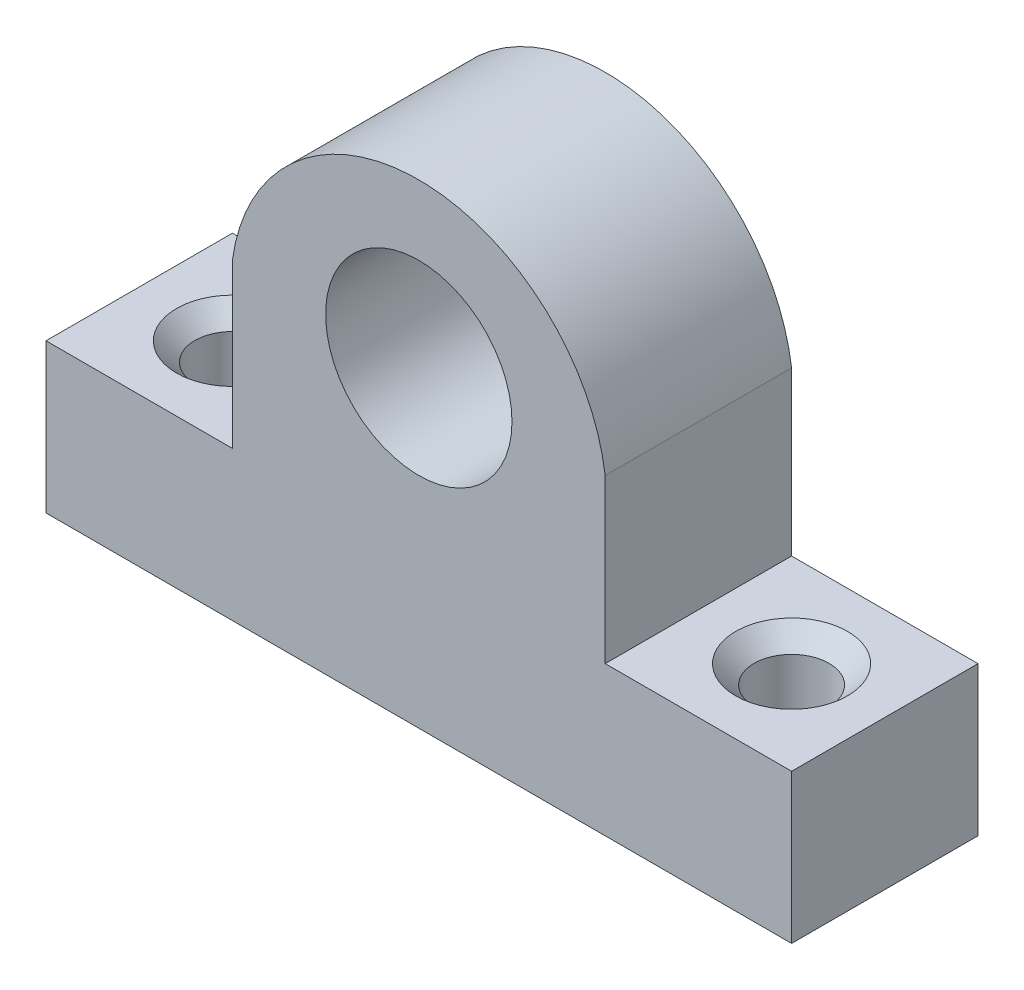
SolidWorks part; units mm, degrees
ref_plane "Front Plane" through (0, 0, 0) normal (0, 0, 1) x (1, 0, 0)
ref_plane "Top Plane" through (0, 0, 0) normal (0, 1, 0) x (1, 0, 0)
ref_plane "Right Plane" through (0, 0, 0) normal (1, 0, 0) x (0, 0, -1)
sketch "Sketch2" plane through (0, 0, 0) normal (0, 0, 1) x (1, 0, 0)
  line L4 (0, 0) -> (50.8, 0)
  line L7 (0, 0) -> (0, 10.16)
  line L8 (0, 10.16) -> (50.8, 10.16)
  line L9 (50.8, 0) -> (50.8, 10.16)
  line L10 (25.4, 10.16) -> (0, 10.16)
  line L11 (12.7, 10.16) -> (12.7, 29.21)
  line L12 (25.4, 10.16) -> (50.8, 10.16)
  line L14 (50.8, 10.16) -> (25.4, 10.16)
  line L16 (38.1, 10.16) -> (38.1, 29.21)
  line L25 (12.7, 10.16) -> (38.1, 10.16)
  line L26 (12.7, 10.16) -> (12.7, 32.3596)
  line L27 (12.7, 32.3596) -> (38.1, 32.3596)
  line L28 (38.1, 10.16) -> (38.1, 32.3596)
  dimension "D1" = 50.8
  dimension "D2" = 10.16
  dimension "D3" = 19.05
extrude "Boss-Extrude1" add sketch "Sketch2" along normal blind 12.7 contours L7 L4 L9 L8 | L26 L25 L28 L27
sketch "Sketch8" plane through (0, 0, 12.7) normal (0, 0, 1) x (1, 0, 0)
  line L0 (12.7, 10.16) -> (12.7, 32.3596) construction
  line L1 (38.1, 10.16) -> (38.1, 32.3596) construction
  line L2 (12.7, 21.2598) -> (12.7, 33.6209)
  line L3 (12.7, 33.6209) -> (38.1, 33.6209)
  line L4 (38.1, 33.6209) -> (38.1, 21.2598)
  arc A0 (12.7, 21.2598) -> (38.1, 21.2598) centre (25.4, 19.5443) cw
extrude "Cut-Extrude3" cut sketch "Sketch8" against normal through all both and the other way through all
sketch "Sketch9" plane through (0, 0, 12.7) normal (0, 0, 1) x (1, 0, 0)
  line L0 (12.7, 21.2598) -> (38.1, 21.2598)
  circle A0 centre (25.4, 21.2598) radius 6.35
  dimension "D1" = 12.7
extrude "Cut-Extrude4" cut sketch "Sketch9" against normal through all both and the other way through all contours A0
sketch "Sketch10" plane through (0, 10.16, 0) normal (0, 1, 0) x (1, 0, 0)
  line L0 (50.8, 0) -> (38.1, 0)
  line L1 (38.1, 0) -> (44.45, 0)
  line L2 (0, 0) -> (6.35, -6.35)
  line L3 (38.1, -12.7) -> (50.8, -12.7) construction
  line L4 (44.45, -12.7) -> (44.45, -6.35)
  line L7 (6.35, -6.35) -> (44.45, -6.35)
  point P9 (44.45, -6.35)
  point P10 (6.35, -6.35)
hole_wizard "1/4-20 Tapped Hole2" positions "Sketch10" profile "Sketch11" tap size "1/4-20" standard "ANSI Inch"
sketch "Sketch11" plane through (6.35, 10.16, 6.35) normal (1, 0, 0) x (0, 0, 1)
  line L0 (0, 0) -> (0, 10.16)
  line L1 (0, 10.16) -> (2.5527, 10.16)
  line L2 (2.5527, 10.16) -> (2.5527, 1.2573)
  line L3 (2.5527, 1.2573) -> (3.81, 0)
  line L5 (3.81, 0) -> (0, 0)
  line L6 (-2.5527, 1.2573) -> (-3.81, 0) construction
  line L11 (0, -6.35) -> (0, 107.95) construction
  dimension "Thru Tap Drill Dia." = 5.1054
  dimension "Thru Tap Drill Depth" = 10.16
  dimension "Near C'Sink Dia." = 7.62
  dimension "Near C'Sink Angle" = 90
